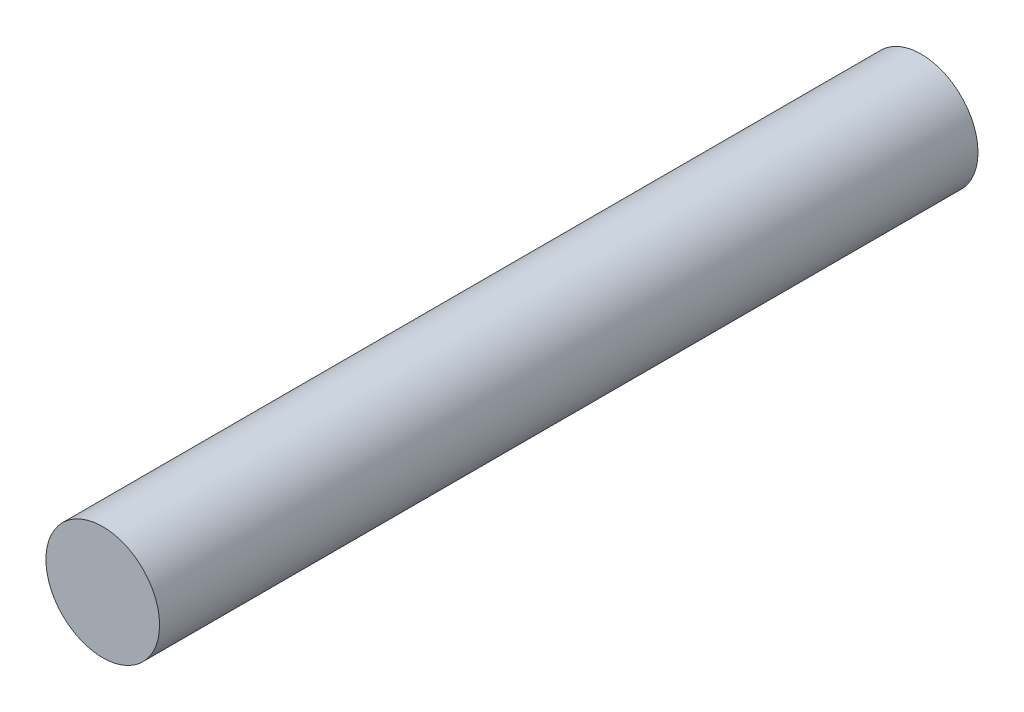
SolidWorks part; units mm, degrees
ref_plane "Front Plane" through (0, 0, 0) normal (0, 0, 1) x (1, 0, 0)
ref_plane "Top Plane" through (0, 0, 0) normal (0, 1, 0) x (1, 0, 0)
ref_plane "Right Plane" through (0, 0, 0) normal (1, 0, 0) x (0, 0, -1)
sketch "Sketch1" plane through (0, 0, 0) normal (0, 0, 1) x (1, 0, 0)
  circle A0 centre (0, 0) radius 1.5875
  dimension "D1" = 3.175
extrude "Extrude1" add sketch "Sketch1" along normal mid plane 22.86
